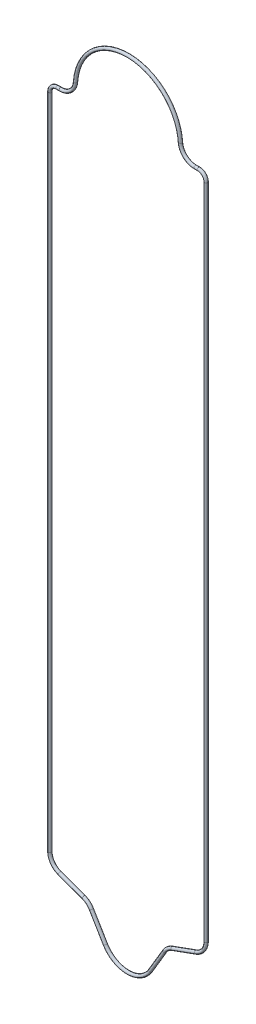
SolidWorks part; units mm, degrees
ref_plane "Plan1" through (0, 0, 0) normal (0, 0, 1) x (1, 0, 0)
ref_plane "Plan2" through (0, 0, 0) normal (0, 1, 0) x (1, 0, 0)
ref_plane "Plan3" through (0, 0, 0) normal (1, 0, 0) x (0, 0, -1)
sketch "Esquisse1" plane through (0, 0, 0) normal (0, 0, 1) x (1, 0, 0)
  line L0 (-8.9793, -1.3899) -> (-9.4065, -1.3899)
  line L1 (-10.4065, -2.3899) -> (-10.4065, -89.9895)
  line L2 (-9.0905, -91.8688) -> (-5.9099, -93.0265)
  line L3 (-4.8736, -93.8859) -> (-3.0106, -97.028)
  line L4 (0, 17.1293) -> (0, -28.0994) construction
  line L5 (4.8736, -93.8859) -> (3.0106, -97.028)
  line L6 (9.0905, -91.8688) -> (5.9099, -93.0265)
  line L7 (10.4065, -2.3899) -> (10.4065, -89.9895)
  line L8 (8.9793, -1.3899) -> (9.4065, -1.3899)
  arc A0 (-6.9839, 0.4745) -> (6.9839, 0.4745) centre (0, 0) cw
  arc A1 (-3.0106, -97.028) -> (0, -98.743) centre (0, -95.243) ccw
  arc A2 (-8.9793, -1.3899) -> (-6.9839, 0.4745) centre (-8.9793, 0.6101) ccw
  arc A3 (-10.4065, -2.3899) -> (-9.4065, -1.3899) centre (-9.4065, -2.3899) cw
  arc A4 (-9.0905, -91.8688) -> (-10.4065, -89.9895) centre (-8.4065, -89.9895) cw
  arc A5 (-4.8736, -93.8859) -> (-5.9099, -93.0265) centre (-6.5939, -94.9059) ccw
  arc A6 (4.8736, -93.8859) -> (5.9099, -93.0265) centre (6.5939, -94.9059) cw
  arc A7 (3.0106, -97.028) -> (0, -98.743) centre (0, -95.243) cw
  arc A8 (9.0905, -91.8688) -> (10.4065, -89.9895) centre (8.4065, -89.9895) ccw
  arc A9 (10.4065, -2.3899) -> (9.4065, -1.3899) centre (9.4065, -2.3899) ccw
  arc A10 (8.9793, -1.3899) -> (6.9839, 0.4745) centre (8.9793, 0.6101) cw
  point P15 (-10.4065, -1.3899)
  point P18 (-10.4065, -91.3899)
  point P21 (-5.2382, -93.271)
  point P36 (5.2382, -93.271)
  point P37 (10.4065, -91.3899)
  point P38 (10.4065, -1.3899)
  dimension "D3" = 95.243
  dimension "D2" = 7
  dimension "D4" = 3.5
  dimension "D7" = 2
  dimension "D8" = 1
  dimension "D9" = 2
  dimension "D1" = 90
  dimension "D5" = 4.3677
  dimension "D6" = 5.5
  dimension "D10" = 110
sketch "Esquisse2" plane through (0, 0, 0) normal (1, 0, 0) x (0, 0, -1)
  line L1 (0, 17.1293) -> (0, -28.0994) construction
  circle A0 centre (0, 7) radius 0.2063
sweep "Balayage1" add profiles "Esquisse2" path "Esquisse1"
ref_plane "Plan4" through (0, 0, 0) normal (1, 0, 0) x (0, 0, -1)
